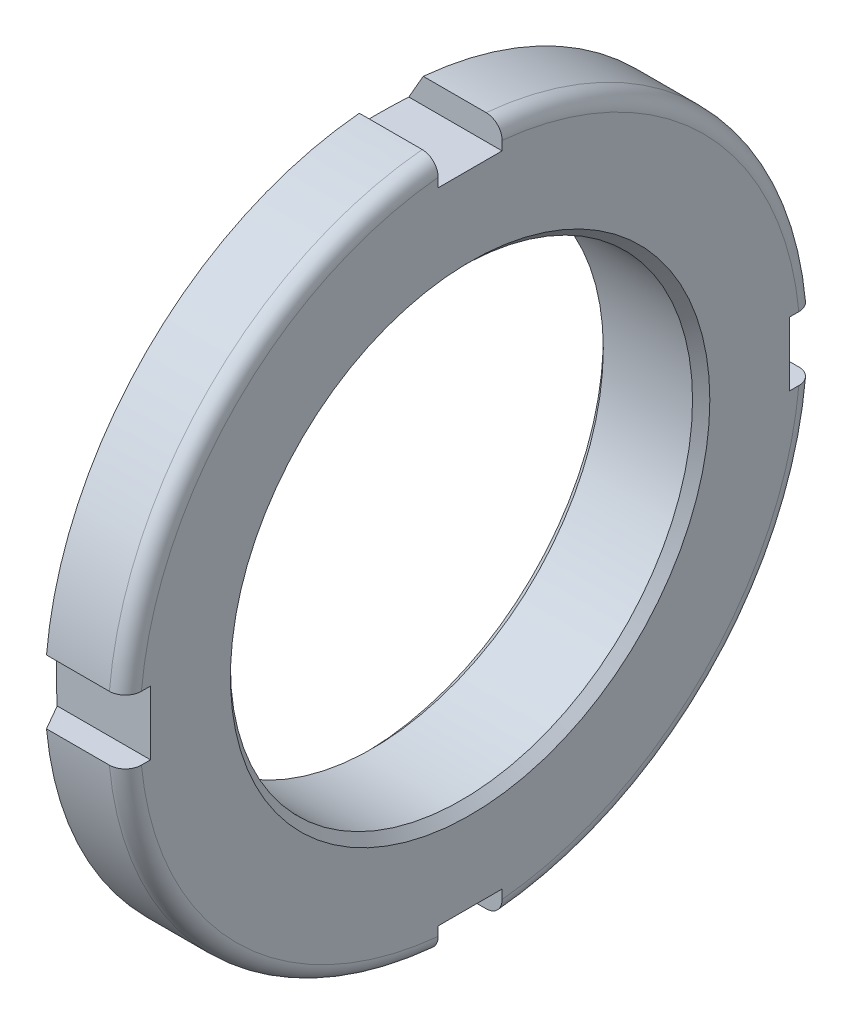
SolidWorks part; units mm, degrees
ref_plane "Front Plane" through (0, 0, 0) normal (0, 0, 1) x (1, 0, 0)
ref_plane "Top Plane" through (0, 0, 0) normal (0, 1, 0) x (1, 0, 0)
ref_plane "Right Plane" through (0, 0, 0) normal (1, 0, 0) x (0, 0, -1)
sketch "Sketch1" plane through (0, 0, 0) normal (0, 0, 1) x (1, 0, 0)
  line L0 (0, 28) -> (0, 0)
  line L1 (0, 0) -> (10, 0)
  line L2 (10, 0) -> (10, 32.5)
  line L3 (10, 32.5) -> (2.5981, 32.5)
  line L4 (2.5981, 32.5) -> (0, 28)
  line L5 (0, 0) -> (10, 0) construction
revolve "Revolve1" add sketch "Sketch1" angle 360 about L5
sketch "Sketch2" plane through (10, 0, 0) normal (1, 0, 0) x (0, 0, -1)
  line L0 (3, -32.3612) -> (3, -30)
  line L1 (3, -30) -> (-3, -30)
  line L2 (-3, -30) -> (-3, -32.3612)
  arc A0 (-3, -32.3612) -> (3, -32.3612) centre (0, 0) ccw
extrude "Cut-Extrude1" cut sketch "Sketch2" against normal up to next
sketch "Sketch3" plane through (10, 0, 0) normal (1, 0, 0) x (0, 0, -1)
  line L0 (32.3612, 3) -> (30, 3)
  line L1 (30, 3) -> (30, -3)
  line L2 (30, -3) -> (32.3612, -3)
  arc A0 (32.3612, -3) -> (32.3612, 3) centre (0, 0) ccw
extrude "Cut-Extrude2" cut sketch "Sketch3" against normal up to next
sketch "Sketch4" plane through (10, 0, 0) normal (1, 0, 0) x (0, 0, -1)
  line L0 (-3, 32.3612) -> (-3, 30)
  line L1 (-3, 30) -> (3, 30)
  line L2 (3, 30) -> (3, 32.3612)
  arc A0 (3, 32.3612) -> (-3, 32.3612) centre (0, 0) ccw
extrude "Cut-Extrude3" cut sketch "Sketch4" against normal up to next
sketch "Sketch5" plane through (10, 0, 0) normal (1, 0, 0) x (0, 0, -1)
  line L0 (-32.3612, -3) -> (-30, -3)
  line L1 (-30, -3) -> (-30, 3)
  line L2 (-30, 3) -> (-32.3612, 3)
  arc A0 (-32.3612, 3) -> (-32.3612, -3) centre (0, 0) ccw
extrude "Cut-Extrude4" cut sketch "Sketch5" against normal up to next
hole_wizard "M39 Clearance Hole1" positions "Sketch7" profile "Sketch6" hole size "M39" standard "ANSI Metric"
sketch "Sketch7" plane through (0, 0, 0) normal (-1, 0, 0) x (0, 0, 1)
  point P0 (0, 0)
sketch "Sketch6" plane through (0, 0, 0) normal (0, 1, 0) x (0, 0, 1)
  line L0 (0, 0) -> (0, 10)
  line L1 (0, 10) -> (21.6881, 10)
  line L2 (21.6881, 10) -> (21.6881, 0)
  line L5 (21.6881, 0) -> (0, 0)
  line L11 (0, -6.35) -> (0, 107.95) construction
  dimension "Thru Hole Dia." = 43.3762
  dimension "Thru Hole Depth" = 10
chamfer "Chamfer1" distance 0.8119 angle 45 2 edges at (10, 0, 21.6881) (0, 0, 21.6881)
fillet "Fillet1" radius 1.5 4 edges at (10, -22.981, -22.981) (10, 22.981, -22.981) (10, -22.981, 22.981) (10, 22.981, 22.981)
